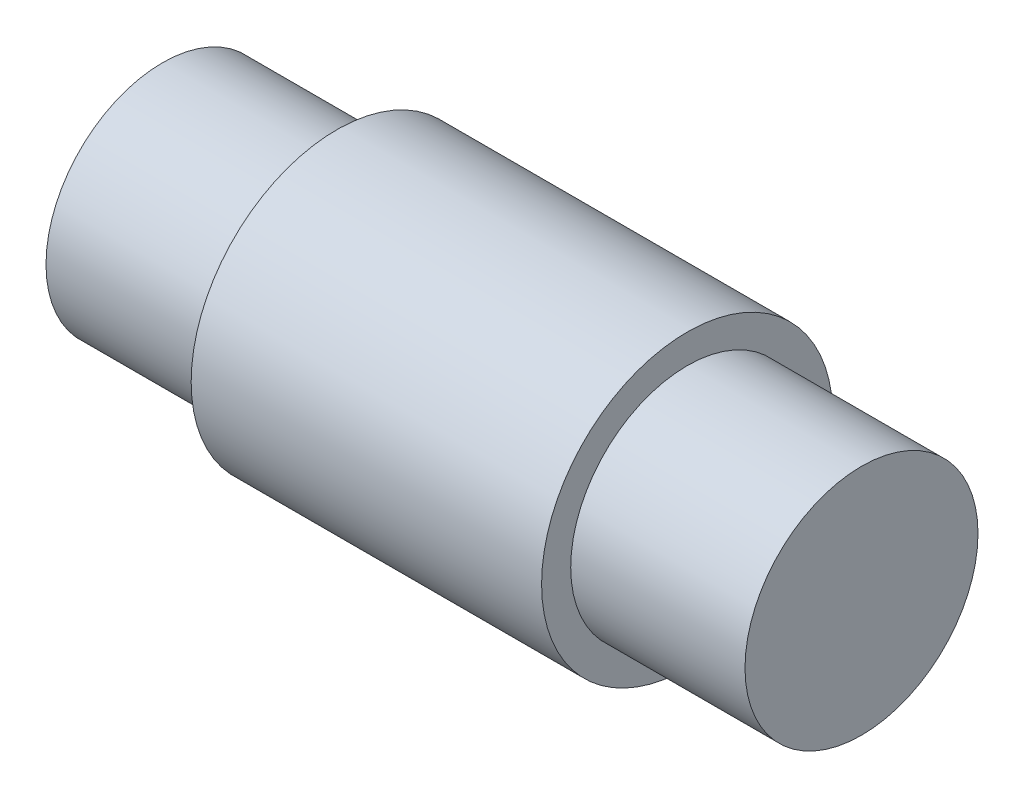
SolidWorks part; units mm, degrees
ref_plane "Front Plane" through (0, 0, 0) normal (0, 0, 1) x (1, 0, 0)
ref_plane "Top Plane" through (0, 0, 0) normal (0, 1, 0) x (1, 0, 0)
ref_plane "Right Plane" through (0, 0, 0) normal (1, 0, 0) x (0, 0, -1)
sketch "Sketch1" plane through (0, 0, 0) normal (0, 0, 1) x (1, 0, 0)
  line L0 (-76.4565, 0) -> (100.0218, 0) construction
  line L1 (-9.525, 0) -> (-9.525, 3.175)
  line L2 (-9.525, 3.175) -> (-4.775, 3.175)
  line L3 (-4.775, 3.175) -> (-4.775, 3.9688)
  line L4 (-4.775, 3.9688) -> (4.775, 3.9688)
  line L5 (4.775, 3.9688) -> (4.775, 3.175)
  line L6 (4.775, 3.175) -> (9.525, 3.175)
  line L7 (9.525, 3.175) -> (9.525, 0)
  line L8 (9.525, 0) -> (-9.525, 0)
  dimension "D1" = 4.75
  dimension "D2" = 19.05
  dimension "D3" = 7.9375
  dimension "D4" = 6.35
revolve "Revolve1" add sketch "Sketch1" angle 360 about L0
